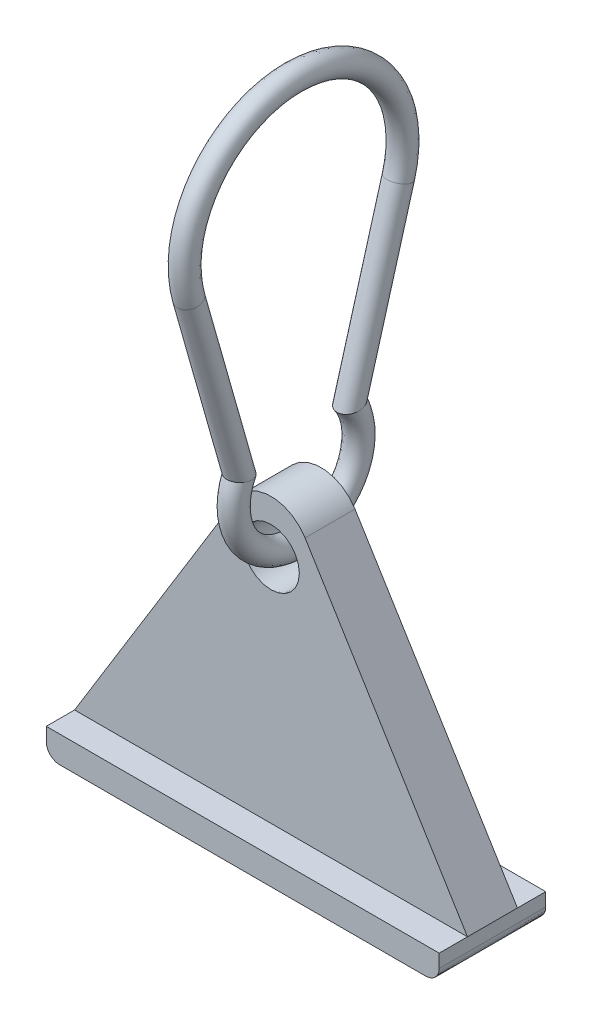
SolidWorks part; units mm, degrees
ref_plane "前视基准面" through (0, 0, 0) normal (0, 0, 1) x (1, 0, 0)
ref_plane "上视基准面" through (0, 0, 0) normal (0, 1, 0) x (1, 0, 0)
ref_plane "右视基准面" through (0, 0, 0) normal (1, 0, 0) x (0, 0, -1)
sketch "草图1" plane through (0, 0, 0) normal (0, 0, 1) x (1, 0, 0)
  line L1 (0, 0) -> (0, 58.742) construction
  line L2 (-29.5, 0) -> (0, 48)
  line L3 (0, 48) -> (29.5, 0)
  line L4 (-29.5, 0) -> (-29.5, -4)
  line L5 (-29.5, -4) -> (29.5, -4)
  line L6 (29.5, -4) -> (29.5, 0)
  dimension "D1" = 59
  dimension "D2" = 48
extrude "凸台-拉伸1" add sketch "草图1" along normal mid plane 16
sketch "草图2" plane through (29.5, 0, 0) normal (1, 0, 0) x (0, 0, -1)
  line L0 (-8, 0) -> (8, 0) construction
  line L1 (-8, 48) -> (-3.75, 48)
  line L2 (-8, 48) -> (-8, 0)
  line L3 (-8, 0) -> (-3.75, 0)
  line L4 (-3.75, 48) -> (-3.75, 0)
  dimension "D1" = 4.25
extrude "切除-拉伸1" cut sketch "草图2" against normal through all
mirror "镜向1" about plane through (0, 0, 0) normal (0, 0, 1) of "切除-拉伸1"
fillet "圆角1" radius 6 1 edges at (0, 48, 0)
sketch "草图3" plane through (0, 0, 3.75) normal (0, 0, 1) x (1, 0, 0)
  line L0 (5.1118, 39.6825) -> (29.5, 0) construction
  line L1 (-29.5, 0) -> (-5.1118, 39.6825) construction
  circle A0 centre (0, 34.6311) radius 4.25
  dimension "D1" = 7
  dimension "D2" = 7
  dimension "D3" = 8.5
extrude "切除-拉伸2" cut sketch "草图3" against normal blind 16 contours A0
fillet "圆角2" radius 2 2 edges at (29.5, -4, 0) (-29.5, -4, 0)
sketch "草图4" plane through (0, 0, 0) normal (0, 0, 1) x (1, 0, 0)
  circle A0 centre (0, 34.6311) radius 1.75
sketch "草图5" plane through (0, 0, 0) normal (1, 0, 0) x (0, 0, -1)
  line L0 (-14.7936, 74.8924) -> (-7.0715, 47.7024)
  line L1 (14.0652, 74.8924) -> (6.586, 48.5574)
  arc A0 (-7.0715, 47.7024) -> (6.586, 48.5574) centre (0.0162, 43.9924) ccw
  arc A1 (14.0652, 74.8924) -> (-14.7936, 74.8924) centre (-0.3642, 78.9904) ccw
  dimension "D1" = 16
  dimension "D2" = 30
  dimension "D3" = 35
sweep "扫描1" add profiles "草图4" path "草图5"
